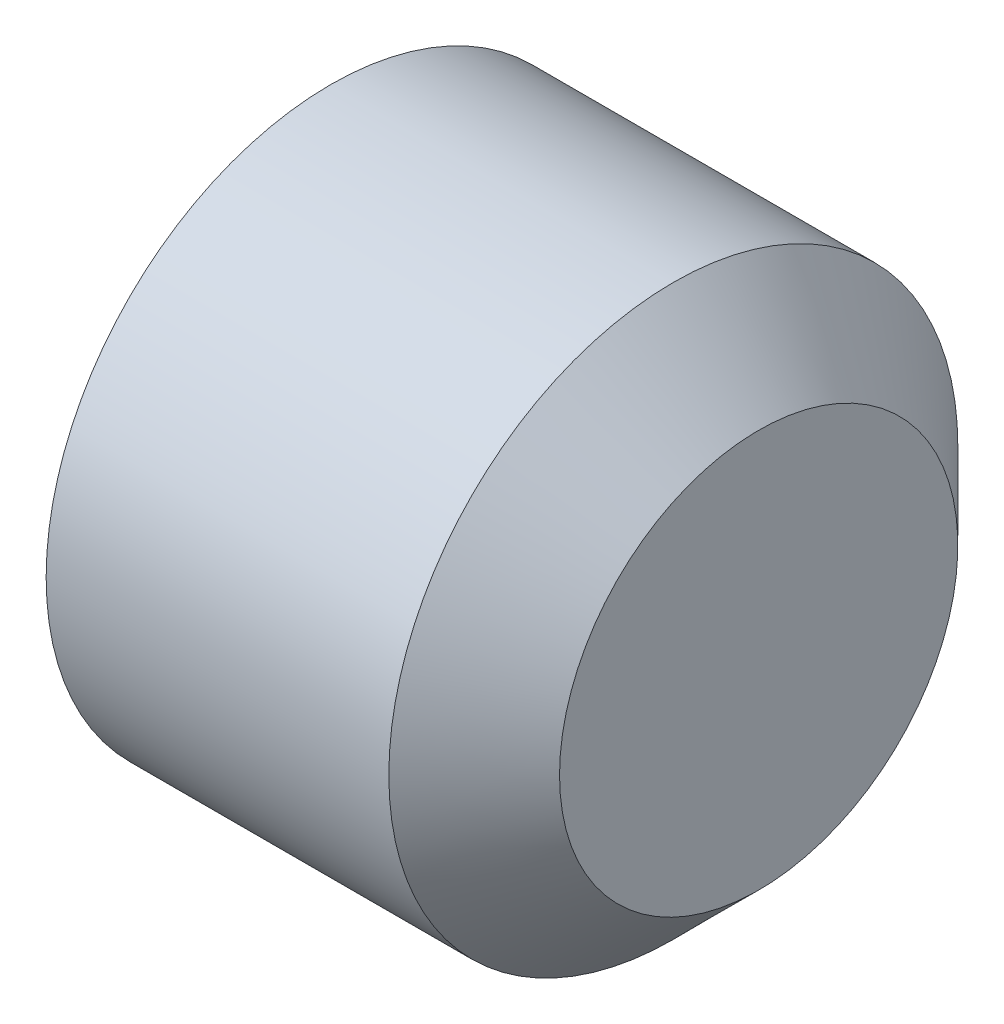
SolidWorks part; units mm, degrees
ref_plane "Plane1" through (0, 0, 0) normal (0, 0, 1) x (1, 0, 0)
ref_plane "Plane2" through (0, 0, 0) normal (0, 1, 0) x (1, 0, 0)
ref_plane "Plane3" through (0, 0, 0) normal (1, 0, 0) x (0, 0, -1)
sketch "BodySke" plane through (0, 0, 0) normal (0, 0, 1) x (1, 0, 0)
  line L0 (0, 0) -> (0, 4.172)
  line L1 (0, 4.172) -> (0.478, 5)
  line L2 (0.478, 5) -> (6.5, 5)
  line L3 (6.5, 5) -> (8, 3.5)
  line L4 (8, 0) -> (0, 0)
  line L5 (-12.7, 0) -> (88.9, 0) construction
  line L6 (8, 3.5) -> (8, 0)
  line L7 (8, 3.5) -> (8, 13.025) construction
  line L8 (0, -4.172) -> (0.478, -5) construction
  line L9 (1.5, 15.875) -> (1.5, -3.175) construction
  line L10 (6.5, -5) -> (8, -3.5) construction
  dimension "Length" = 8
  dimension "Diameter" = 10
  dimension "Drive_ch_ang" = 60
  dimension "Minor_dia" = 8.344
  dimension "Cup_nose_ang" = 45
  dimension "Cup_dia" = 7
  dimension "Advance" = 1.5
revolve "BaseBody" add sketch "BodySke" angle 360 about L5
sketch "Sketch2" plane through (0, 0, 0) normal (-1, 0, 0) x (0, 0, 1)
  line L0 (1.4434, 2.5) -> (-1.4434, 2.5)
  line L1 (-1.4434, 2.5) -> (-2.8868, 0)
  line L2 (1.4434, 2.5) -> (2.8868, 0)
  line L3 (1.4434, -2.5) -> (2.8868, 0)
  line L4 (1.4434, -2.5) -> (-1.4434, -2.5)
  line L5 (-1.4434, -2.5) -> (-2.8868, 0)
  dimension "Hex_size" = 5
  dimension "D2" = 2.5
  dimension "D3" = 2.5
extrude "Hex" cut sketch "Sketch2" against normal blind 4
sketch "ThdSchSke" plane through (0, 0, 0) normal (0, 0, 1) x (1, 0, 0)
  line L0 (0.478, -4.172) -> (-0.1017, -5)
  line L1 (0.478, -4.172) -> (1.0578, -5)
  line L2 (1.0578, -5) -> (1.0578, -6.25)
  line L3 (-3.175, 0) -> (5.1513, 0) construction
  line L5 (1.0578, -6.25) -> (-0.1017, -6.25)
  line L6 (-0.1017, -6.25) -> (-0.1017, -5)
  line L8 (0.478, 5) -> (0.478, -5) construction
  dimension "Thread_minor" = 8.344
  dimension "Diameter" = 10
  dimension "SideAngle" = 55
  dimension "VeeAngle" = 70
  dimension "Overcut" = 12.5
revolve "ThreadSchematic" [suppressed] cut sketch "ThdSchSke" angle 360 about L3
pattern_linear "ThdSchPat" [suppressed]
equation "\"D2@Sketch2\" = \"Hex_size@Sketch2\" / 2"
equation "\"D3@Sketch2\" = \"Hex_size@Sketch2\" / 2"
equation "\"Thread_minor@ThreadCosmetic\" = \"Minor_dia@BodySke\""
equation "\"Thread_minor@ThdSchSke\" = \"Thread_minor@ThreadCosmetic\""
equation "\"Diameter@ThdSchSke\" = \"Diameter@BodySke\""
equation "\"Overcut@ThdSchSke\" = \"Diameter@BodySke\" * 1.25"
equation "\"Num_threads@ThdSchPat\" = int( (\"Length@BodySke\" - ( ( ( \"Diameter@BodySke\" - \"Minor_dia@BodySke\" ) * 0.5 ) / tan( \"Drive_ch_ang@BodySke\" * 0.017453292 ) ) - ( ( ( \"Diameter@BodySke\" - \"Cup_dia@BodySk"
equation "\"Advance@ThdSchPat\" = (\"Length@BodySke\" - ( ( ( \"Diameter@BodySke\" - \"Minor_dia@BodySke\" ) * 0.5 ) / tan( \"Drive_ch_ang@BodySke\" * 0.017453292 ) ) - ( ( ( \"Diameter@BodySke\" - \"Cup_dia@BodySke\" ) * 0."
equation "' \"Num_threads@ThdSchPat\" = \"Num_threads@ThdSchPat\" - sgn( \"Num_threads@ThdSchPat\" - 1) '---chamfered tips only---"
